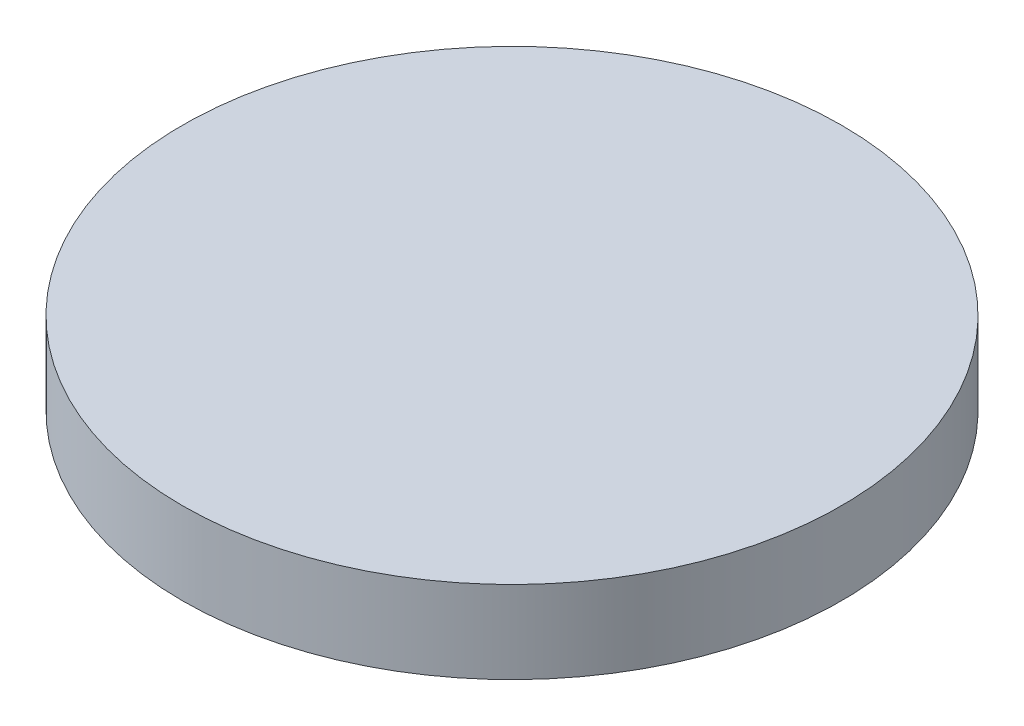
SolidWorks part; units mm, degrees
ref_plane "Front Plane" through (0, 0, 0) normal (0, 0, 1) x (1, 0, 0)
ref_plane "Top Plane" through (0, 0, 0) normal (0, 1, 0) x (1, 0, 0)
ref_plane "Right Plane" through (0, 0, 0) normal (1, 0, 0) x (0, 0, -1)
sketch "Sketch1" plane through (0, 0, 0) normal (0, 1, 0) x (1, 0, 0)
  circle A0 centre (0, 0) radius 50.8
  dimension "D1" = 101.6
extrude "Boss-Extrude1" add sketch "Sketch1" along normal blind 12.7
